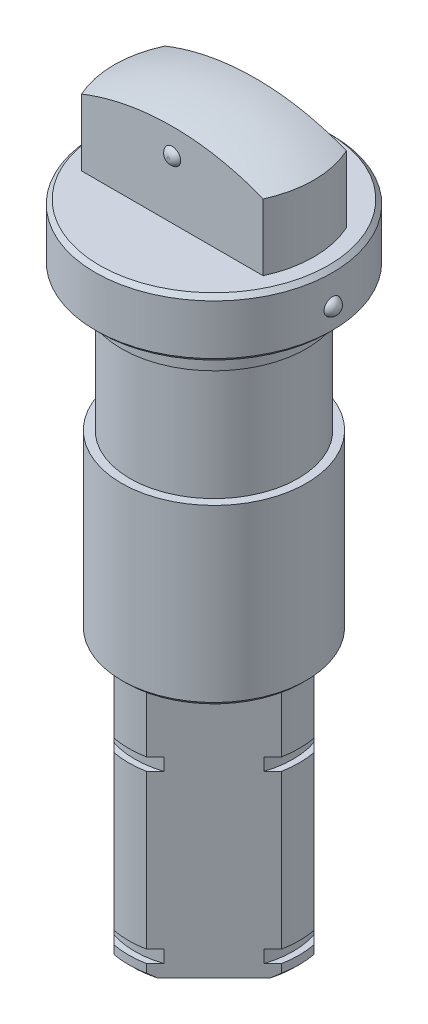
SolidWorks part; units mm, degrees
ref_plane "前基準面" through (0, 0, 0) normal (0, 0, 1) x (1, 0, 0)
ref_plane "上基準面" through (0, 0, 0) normal (0, 1, 0) x (1, 0, 0)
ref_plane "右基準面" through (0, 0, 0) normal (1, 0, 0) x (0, 0, -1)
sketch "草圖1" plane through (0, 0, 0) normal (0, 0, 1) x (1, 0, 0)
  line L0 (0, 35.0226) -> (0, -35.0226) construction
  line L1 (0, 42.75) -> (0, -42.75)
  line L3 (12, 40.2455) -> (12, 32.25)
  line L4 (12, 32.25) -> (14.25, 32.25)
  line L5 (14.25, 32.25) -> (14.25, 25.25)
  line L6 (14.25, 25.25) -> (11.1, 25.25)
  line L7 (11.1, 25.25) -> (11.1, 22.25)
  line L8 (11.1, 22.25) -> (10.1, 22.25)
  line L9 (10.1, 22.25) -> (10.1, 8.25)
  line L10 (10.1, 8.25) -> (11.1, 8.25)
  line L11 (11.1, 8.25) -> (11.1, -12.75)
  line L12 (11.1, -12.75) -> (10.25, -12.75)
  line L13 (10.25, -12.75) -> (10.25, -19.75)
  line L14 (10.25, -19.75) -> (9.5, -19.75)
  line L15 (9.5, -19.75) -> (9.5, -21.25)
  line L16 (9.5, -21.25) -> (10.25, -21.25)
  line L17 (10.25, -41.25) -> (10.25, -42.75)
  line L18 (10.25, -39.75) -> (9.5, -39.75)
  line L19 (9.5, -39.75) -> (9.5, -41.25)
  line L20 (9.5, -41.25) -> (10.25, -41.25)
  line L21 (10.25, -21.25) -> (10.25, -39.75)
  line L22 (10.25, -42.75) -> (0, -42.75)
  arc A0 (12, 40.2455) -> (0, 42.75) centre (0, 12.75) ccw
  dimension "D14" = 17.5
  dimension "D7" = 30
  dimension "D2" = 17
  dimension "D3" = 20.5
  dimension "D4" = 19
  dimension "D5" = 22.2
  dimension "D6" = 7
  dimension "D8" = 3
  dimension "D9" = 38
  dimension "D10" = 20.2
  dimension "D11" = 21.5
  dimension "D12" = 7
  dimension "D13" = 85.5
  dimension "D15" = 24
  dimension "D16" = 1.5
  dimension "D17" = 28.5
revolve "旋轉1" add sketch "草圖1" angle 360 about L0
sketch "草圖4" plane through (0, 32.25, 0) normal (0, 1, 0) x (-1, 0, 0)
  line L0 (-15.0903, 0) -> (15.0903, 0) construction
  line L1 (-14.25, -5) -> (-14.25, -14.25)
  line L2 (-14.25, 5) -> (14.25, 5)
  line L3 (-14.25, 5) -> (-14.25, 14.25)
  line L4 (-14.25, 14.25) -> (14.25, 14.25)
  line L5 (14.25, 5) -> (14.25, 14.25)
  line L6 (-14.25, -14.25) -> (14.25, -14.25)
  line L7 (-14.25, -5) -> (14.25, -5)
  line L8 (14.25, -5) -> (14.25, -14.25)
  circle A0 centre (0, 0) radius 14.25 construction
  dimension "D1" = 10
extrude "除料-伸長1" cut sketch "草圖4" along normal blind 11
sketch "草圖11" plane through (0, -42.75, 0) normal (0, -1, 0) x (1, 0, 0)
  line L0 (0, 8.5184) -> (0, -8.5184) construction
  line L2 (0.6, 11.1) -> (-0.6, 11.1)
  line L3 (0.6, 11.1) -> (0.6, -11.1)
  line L4 (0.6, -11.1) -> (-0.6, -11.1)
  line L5 (-0.6, 11.1) -> (-0.6, -11.1)
  circle A1 centre (0, 0) radius 11.1 construction
  circle A2 centre (0, 0) radius 11.1 construction
  dimension "D2" = 1.2
chamfer "導角3" distance 0.5 angle 45 4 edges at (0, -12.75, 11.1) (0, -42.75, 10.25) (0, 32.25, 14.25) (0, 25.25, 14.25)
extrude "除料-伸長4" cut sketch "草圖11" against normal blind 0.5
sketch "草圖16" plane through (0, 0, 5) normal (0, 0, 1) x (1, 0, 0)
  line L0 (0, 0) -> (0, 33.4155) construction
  line L1 (10.9087, 32.25) -> (-10.9087, 32.25) construction
  circle A0 centre (0, 39.25) radius 1
  dimension "D1" = 2
  dimension "D2" = 7
extrude "伸長1" add sketch "草圖16" along normal blind 0.5
sketch "草圖19" plane through (0, 0, 0) normal (1, 0, 0) x (0, 0, -1)
  line L0 (-11.1, 25.25) -> (11.1, 25.25) construction
  line L2 (0, 0) -> (0, 21.3639) construction
  circle A0 centre (0, 28.25) radius 1
  dimension "D2" = 2
  dimension "D1" = 3
extrude "伸長2" add sketch "草圖19" along normal blind 15
fillet "圓角2" radius 1 2 edges at (1, 39.25, 5.5) (15, 28.25, -1)
sketch "草圖17" plane through (0, -42.75, 0) normal (0, -1, 0) x (1, 0, 0)
  line L0 (-10.1604, 0) -> (10.1604, 0) construction
  line L1 (0, 10.3461) -> (0, -10.2718) construction
  line L2 (0, 12.0208) -> (-12.0208, 0)
  line L3 (0, 12.0208) -> (12.0208, 0)
  line L4 (-12.0208, 0) -> (0, -12.0208)
  line L5 (12.0208, 0) -> (0, -12.0208)
  circle A0 centre (0, 0) radius 14.25
  circle A1 centre (0, 0) radius 14.25 construction
  dimension "D1" = 17
extrude "除料-伸長5" cut sketch "草圖17" against normal up to surface (30 mm away)
sketch "草圖18" plane through (0, 0, 0) normal (1, 0, 0) x (0, 0, -1)
  line L0 (-2.6331, -42.75) -> (-9.3877, -42.75) construction
  line L1 (-14.25, 42.75) -> (14.25, 42.75) construction
  line L2 (-14.25, 42.75) -> (-14.25, -42.75) construction
  line L3 (-14.25, -42.75) -> (14.25, -42.75) construction
  line L4 (14.25, 42.75) -> (14.25, -42.75) construction
  line L5 (-14.25, 31.75) -> (-14.25, 25.75) construction
  line L6 (14.25, 25.75) -> (14.25, 31.75) construction
  line L7 (14.25, 42.75) -> (-14.25, -42.75) construction
  arc A1 (5, 42.3304) -> (-5, 42.3304) centre (0, 12.75) ccw construction
